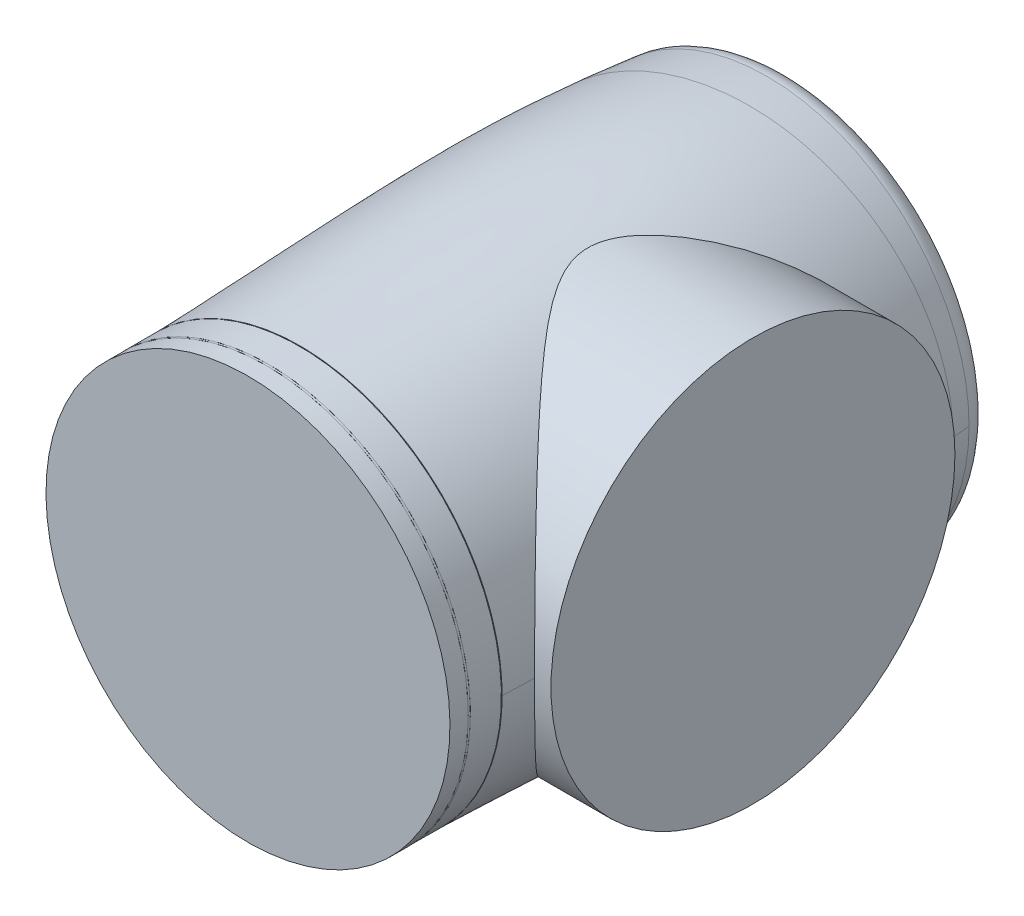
SolidWorks part; units mm, degrees
ref_plane "前视基准面" through (0, 0, 0) normal (0, 0, 1) x (1, 0, 0)
ref_plane "上视基准面" through (0, 0, 0) normal (0, 1, 0) x (1, 0, 0)
ref_plane "右视基准面" through (0, 0, 0) normal (1, 0, 0) x (0, 0, -1)
imported_body "输入1"
sketch "草图1" plane through (0, 0, 0) normal (0, 1, 0) x (1, 0, 0)
  line L0 (29.4448, -365.5274) -> (29.2762, -365.5274)
  line L2 (29.4448, -374.0274) -> (29.4448, -350.3274) construction
  line L3 (29.2762, -365.5274) -> (29.2762, -365.5074)
  line L4 (29.2762, -365.5074) -> (29.4448, -365.5074)
  line L5 (29.4448, -365.5074) -> (29.4448, -365.5274)
  line L6 (-153.3864, -374.0274) -> (29.4448, -374.0274) construction
  line L7 (-61.9708, -374.0274) -> (-61.9708, -323.9234) construction
  line L8 (29.4448, -364.5474) -> (29.2568, -364.5474)
  line L9 (29.4448, -364.5474) -> (29.4448, -364.5274)
  line L10 (29.4448, -364.5274) -> (29.2568, -364.5274)
  line L11 (29.2568, -364.5474) -> (29.2568, -364.5274)
  dimension "D1" = 8.5
  dimension "D2" = 0.02
  dimension "D3" = 0.02
  dimension "D4" = 1
revolve "切除-旋转1" [suppressed] cut sketch "草图1" angle 360 about L7
sketch "草图2" plane through (0, 0, 374.0274) normal (0, 0, 1) x (1, 0, 0)
  line L0 (-156.5552, 18.2438) -> (29.4448, 18.2438) construction
  circle A0 centre (-63.5552, 18.2438) radius 93
ref_plane "基准面1" through (0, 18.2438, 0) normal (0, -1, 0) x (1, 0, 0)
sketch "草图3" plane through (0, 18.2438, 0) normal (0, -1, 0) x (1, 0, 0)
  line L0 (-156.5552, 374.0274) -> (29.4448, 374.0274) construction
  line L1 (28.8885, 365.6274) -> (29.9215, 365.6274)
  line L2 (28.8885, 365.6274) -> (28.8885, 365.6074)
  line L3 (28.8885, 365.6074) -> (29.9215, 365.6074)
  line L4 (29.9215, 365.6274) -> (29.9215, 365.6074)
  line L5 (28.9007, 364.6474) -> (29.9337, 364.6474)
  line L6 (28.9007, 364.6474) -> (28.9007, 364.6274)
  line L7 (28.9007, 364.6274) -> (29.9337, 364.6274)
  line L8 (29.9337, 364.6474) -> (29.9337, 364.6274)
  line L9 (-63.5552, 374.0274) -> (-63.5552, 96.6209) construction
  dimension "D1" = 8.4
  dimension "D2" = 0.02
  dimension "D3" = 0.02
  dimension "D4" = 1
revolve "切除-旋转2" cut sketch "草图3" angle 360 about L9
